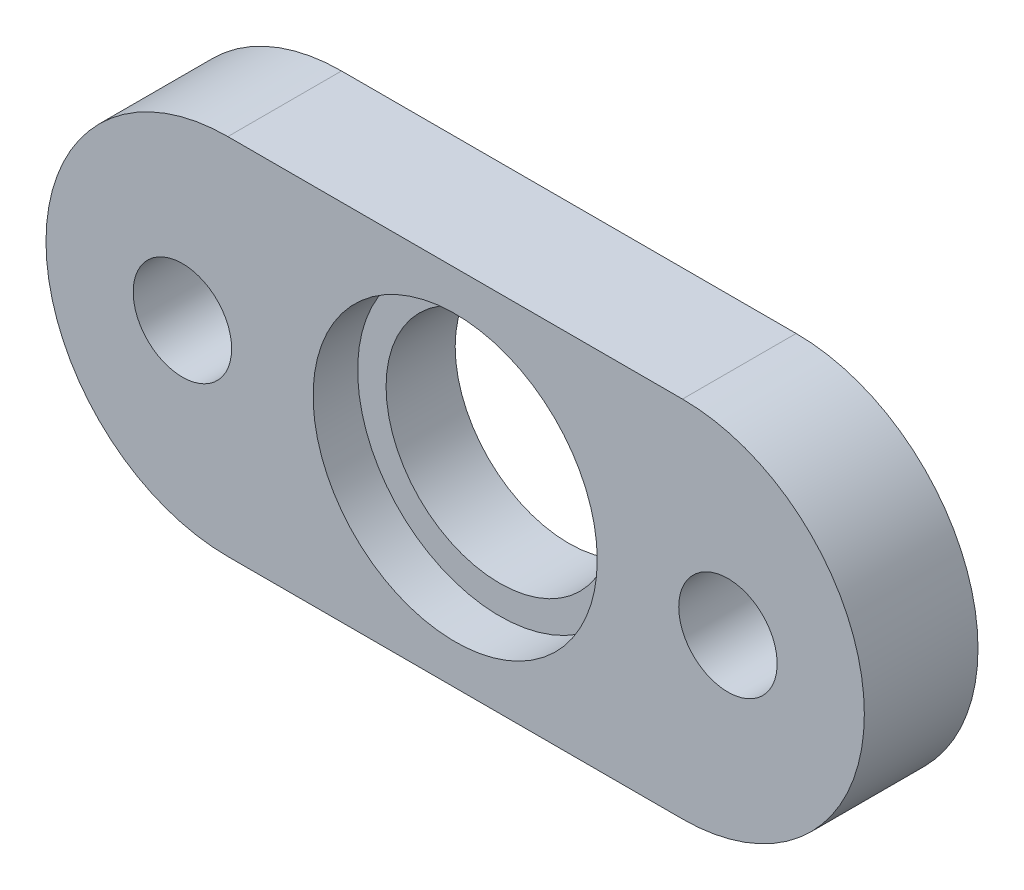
SolidWorks part; units mm, degrees
ref_plane "Front Plane" through (0, 0, 0) normal (0, 0, 1) x (1, 0, 0)
ref_plane "Top Plane" through (0, 0, 0) normal (0, 1, 0) x (1, 0, 0)
ref_plane "Right Plane" through (0, 0, 0) normal (1, 0, 0) x (0, 0, -1)
sketch "Sketch2" plane through (0, 0, 0) normal (0, 0, 1) x (1, 0, 0)
  line L0 (-12.7, 0) -> (12.7, 0) construction
  line L1 (-12.7, 10.16) -> (12.7, 10.16)
  line L2 (-12.7, -10.16) -> (12.7, -10.16)
  arc A0 (-12.7, 10.16) -> (-12.7, -10.16) centre (-12.7, 0) ccw
  arc A1 (12.7, -10.16) -> (12.7, 10.16) centre (12.7, 0) ccw
  point P2 (0, 0)
  point P13 (-28.575, 25.4)
  dimension "D2" = 10.16
  dimension "D1" = 25.4
extrude "Boss-Extrude5" add sketch "Sketch2" along normal blind 6.35
sketch "Sketch5" plane through (0, 0, 6.35) normal (0, 0, 1) x (1, 0, 0)
  circle A0 centre (0, 0) radius 7.9375
  dimension "D1" = 15.875
extrude "Cut-Extrude3" cut sketch "Sketch5" against normal blind 2.4892
sketch "Sketch6" plane through (0, 0, 6.35) normal (0, 0, 1) x (1, 0, 0)
  line L0 (-22.86, 0) -> (22.86, 0) construction
  line L1 (0, 10.16) -> (0, -10.16) construction
  line L2 (12.7, 10.16) -> (-12.7, 10.16) construction
  line L3 (-12.7, -10.16) -> (12.7, -10.16) construction
  circle A0 centre (0, 0) radius 6.35
  arc A1 (-12.7, 10.16) -> (-12.7, -10.16) centre (-12.7, 0) ccw construction
  arc A2 (12.7, -10.16) -> (12.7, 10.16) centre (12.7, 0) ccw construction
  circle A3 centre (-15.24, 0) radius 2.75
  circle A4 centre (15.24, 0) radius 2.75
  dimension "D1" = 12.7
  dimension "D2" = 5.5
  dimension "D3" = 30.48
extrude "Cut-Extrude4" cut sketch "Sketch6" against normal through all
